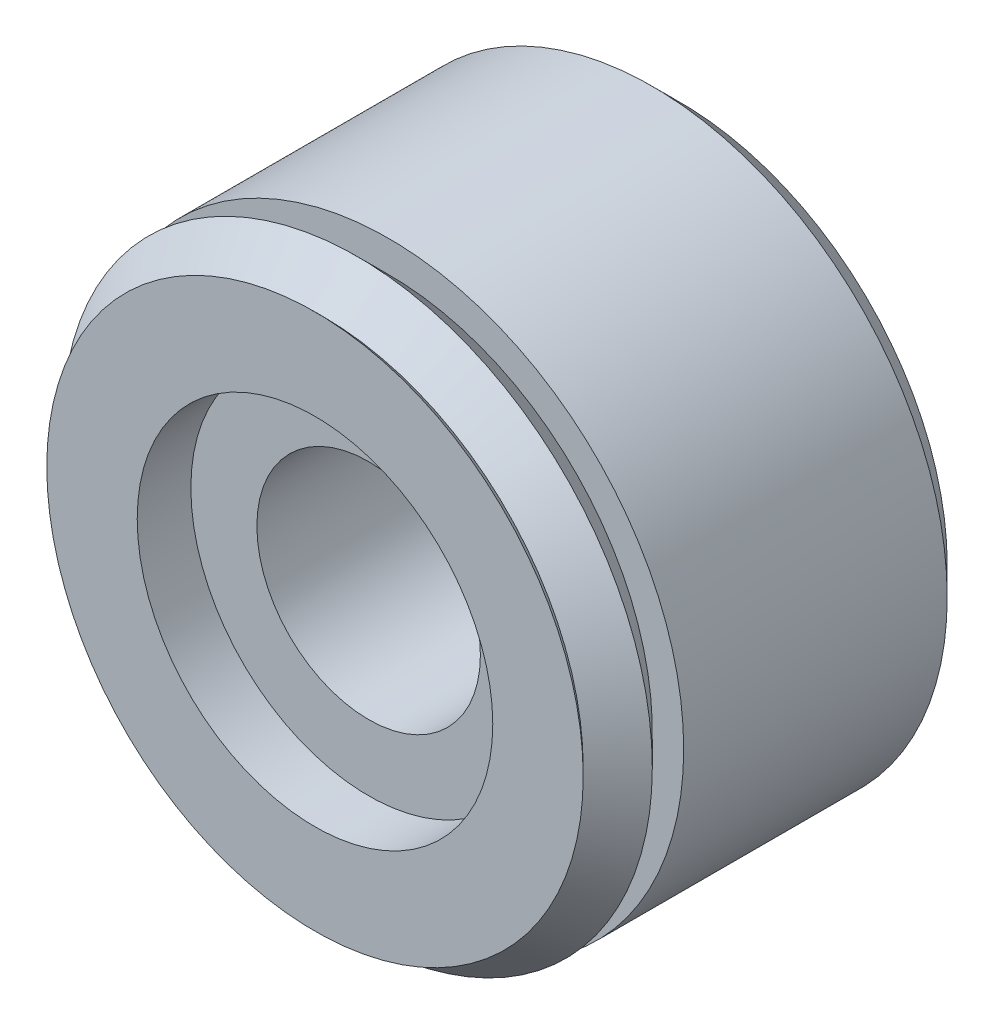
SolidWorks part; units mm, degrees
ref_plane "Front" through (0, 0, 0) normal (0, 0, 1) x (1, 0, 0)
ref_plane "Top" through (0, 0, 0) normal (0, 1, 0) x (1, 0, 0)
ref_plane "Right" through (0, 0, 0) normal (1, 0, 0) x (0, 0, -1)
sketch "Sketch1" plane through (0, 0, 0) normal (1, 0, 0) x (0, 0, -1)
  line L0 (71.2941, 0) -> (-67.6458, 0) construction
  line L1 (0, 0) -> (0, 7.62)
  line L2 (0, 7.62) -> (0.2197, 7.4003)
  line L3 (0.2197, 7.4003) -> (1.2014, 8.382)
  line L4 (1.2014, 8.382) -> (2.0932, 7.4902)
  line L5 (2.0932, 7.4902) -> (2.0932, 8.382)
  line L6 (2.0932, 8.382) -> (10.3736, 8.382)
  line L7 (10.3736, 8.382) -> (10.3736, 0)
  line L8 (10.3736, 0) -> (0, 0)
  dimension "D1" = 45
  dimension "D2" = 8.382
  dimension "D3" = 8.382
  dimension "D4" = 0.8918
  dimension "D5" = 1.2014
  dimension "D6" = 7.62
  dimension "Back Length" = 8.2804
revolve "Base" add sketch "Sketch1" angle 360 about L0
chamfer "Back Chamfer" distance 0.7937 angle 45 1 edges at (-8.382, 0, -10.3736)
sketch "Sketch2" plane through (0, 0, -10.3736) normal (0, 0, -1) x (-1, 0, 0)
  line L0 (6.6282, 0) -> (-6.4494, 0) construction
  line L1 (7.62, 4.7625) -> (-7.62, 4.7625)
  line L2 (7.62, -4.7625) -> (-7.62, -4.7625)
  line L3 (-7.62, 4.7625) -> (-7.62, 17.4625)
  line L4 (-7.62, -4.7625) -> (-7.62, -17.4625)
  line L5 (-7.62, 17.4625) -> (7.62, 17.4625)
  line L6 (-7.62, -17.4625) -> (7.62, -17.4625)
  line L7 (7.62, 17.4625) -> (7.62, 4.7625)
  line L8 (7.62, -17.4625) -> (7.62, -4.7625)
  point P5 (0, 4.7625)
  dimension "D1" = 9.525
  dimension "D2" = 12.7
  dimension "D3" = 15.24
extrude "Flats Cut" [suppressed] cut sketch "Sketch2" against normal blind 3.9688
sketch "Sketch4" plane through (0, 0, -10.3736) normal (0, 0, -1) x (-1, 0, 0)
  circle A0 centre (0, 0) radius 9.525
  dimension "D1" = 19.05
extrude "Body" [suppressed] add sketch "Sketch4" along normal blind 9.525
sketch "Sketch5" [suppressed] plane through (0, 0, -16.6982) normal (0, 0, -1) x (-1, 0, 0)
  circle A0 centre (0, 0) radius 6.35
  dimension "D1" = 12.7
extrude "Body 2" [suppressed] add sketch "Sketch5" along normal blind 12.7
chamfer "Body Chamfer" [suppressed] distance 0.7937 angle 45
sketch "Sketch6" [suppressed] plane through (0, 0, -26.2232) normal (0, 0, -1) x (-1, 0, 0)
  line L0 (0, 6.5811) -> (0, -6.7371) construction
  line L1 (-3.9687, 6.35) -> (-3.9687, -6.35)
  line L2 (3.9688, 6.35) -> (6.5088, 6.35)
  line L3 (3.9688, 6.35) -> (3.9688, -6.35)
  line L4 (3.9688, -6.35) -> (6.5088, -6.35)
  line L5 (6.5088, 6.35) -> (6.5088, -6.35)
  line L6 (-3.9687, 6.35) -> (-6.5087, 6.35)
  line L7 (-6.5087, 6.35) -> (-6.5087, -6.35)
  line L8 (-3.9687, -6.35) -> (-6.5087, -6.35)
  point P11 (3.9688, 0)
  dimension "D1" = 7.9375
  dimension "D2" = 2.54
  dimension "D3" = 12.7
extrude "Body 2 Flats Cut" [suppressed] cut sketch "Sketch6" against normal blind 11.8872
sketch "Sketch7" [suppressed] plane through (3.9687, 0, 0) normal (1, 0, 0) x (0, 0, -1)
  line L0 (12.7295, 0) -> (3.9982, 0) construction
  line L1 (26.2232, -3.8886) -> (26.2232, 3.8886) construction
  circle A0 centre (19.8732, 0) radius 1.9812
  dimension "D2" = 3.9624
  dimension "D1" = 6.35
extrude "Body 2 Hole Cut" [suppressed] cut sketch "Sketch7" against normal through all
sketch "Sketch8" [suppressed] plane through (0, 0, 0) normal (1, 0, 0) x (0, 0, -1)
  line L0 (15.9045, 0) -> (3.9982, 0) construction
  line L1 (3.9982, 9.525) -> (3.9982, -9.525) construction
  circle A0 centre (8.5194, 0) radius 2.032
  dimension "D1" = 4.064
  dimension "B4 Body Hole Distance" = 4.7752
extrude "B1" [suppressed] cut sketch "Sketch8" along normal through all
sketch "Sketch12" [suppressed] plane through (0, 0, 0) normal (0, 1, 0) x (1, 0, 0)
  line L0 (-9.525, 3.9982) -> (9.525, 3.9982) construction
  circle A0 centre (0, 8.5194) radius 2.032
  dimension "D1" = 4.064
  dimension "B1 Body Hole Distance" = 4.7752
extrude "B2" [suppressed] cut sketch "Sketch12" along normal through all
sketch "Sketch9" [suppressed] plane through (0, 0, 0) normal (1, 0, 0) x (0, 0, -1)
  line L2 (3.9982, 9.525) -> (3.9982, -9.525) construction
  circle A0 centre (8.5194, 0) radius 2.032
  dimension "D1" = 4.064
  dimension "B2 Body Hole Distance" = 4.7752
extrude "B3" [suppressed] cut sketch "Sketch9" against normal through all
sketch "Sketch13" [suppressed] plane through (0, 0, 0) normal (0, 1, 0) x (1, 0, 0)
  line L1 (-9.525, 3.9982) -> (9.525, 3.9982) construction
  circle A0 centre (0, 8.5194) radius 2.032
  dimension "D1" = 4.064
  dimension "B3 Body Hole Distance" = 4.7752
extrude "B4" [suppressed] cut sketch "Sketch13" against normal through all
sketch "Sketch3" plane through (0, 0, 0) normal (0, 0, -1) x (-1, 0, 0)
  circle A0 centre (0, 0) radius 3.175
  dimension "D1" = 6.35
extrude "Hole Cut" cut sketch "Sketch3" along normal through all
sketch "Sketch14" plane through (0, 0, 0) normal (0, 0, 1) x (1, 0, 0)
  circle A0 centre (0, 0) radius 5.0509
extrude "Cut-Extrude1" cut sketch "Sketch14" against normal blind 1.524
